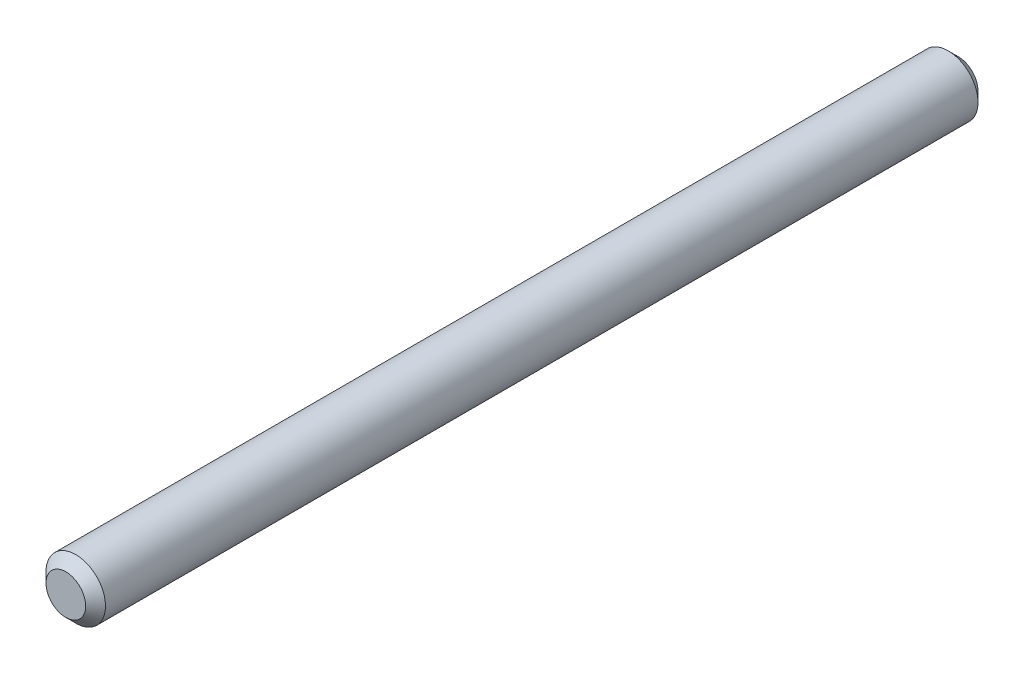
SolidWorks part; units mm, degrees
ref_plane "前视" through (0, 0, 0) normal (0, 0, 1) x (1, 0, 0)
ref_plane "上视" through (0, 0, 0) normal (0, 1, 0) x (1, 0, 0)
ref_plane "右视" through (0, 0, 0) normal (1, 0, 0) x (0, 0, -1)
sketch "草图1" plane through (0, 0, 0) normal (0, 0, 1) x (1, 0, 0)
  circle A0 centre (0, 0) radius 1.5
  dimension "D1" = 3
extrude "凸台-拉伸1" add sketch "草图1" along normal blind 45
chamfer "倒角1" distance 0.5 angle 45 2 edges at (1.5, 0, 0) (1.5, 0, 45)
